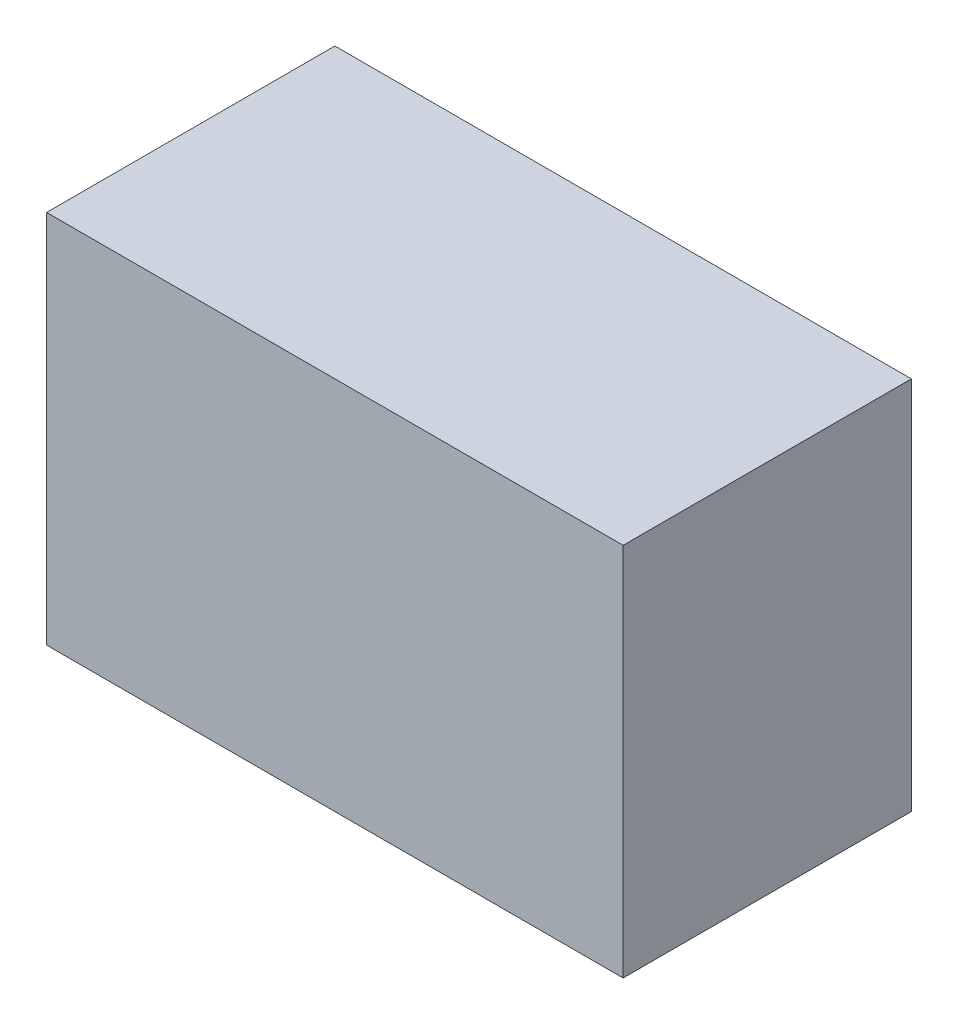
SolidWorks part; units mm, degrees
ref_plane "Front Plane" through (0, 0, 0) normal (0, 0, 1) x (1, 0, 0)
ref_plane "Top Plane" through (0, 0, 0) normal (0, 1, 0) x (1, 0, 0)
ref_plane "Right Plane" through (0, 0, 0) normal (1, 0, 0) x (0, 0, -1)
sketch "GENERAL" plane through (0, 0, 0) normal (0, 0, 1) x (1, 0, 0)
  line L16 (-2.54, -2.413) -> (2.54, -2.413)
  line L17 (2.54, -2.413) -> (2.54, 0.889)
  line L18 (2.54, 0.889) -> (-2.54, 0.889)
  line L19 (-2.54, 0.889) -> (-2.54, -2.413)
extrude "Boss-Extrude1" add sketch "GENERAL" along normal blind 2.54
